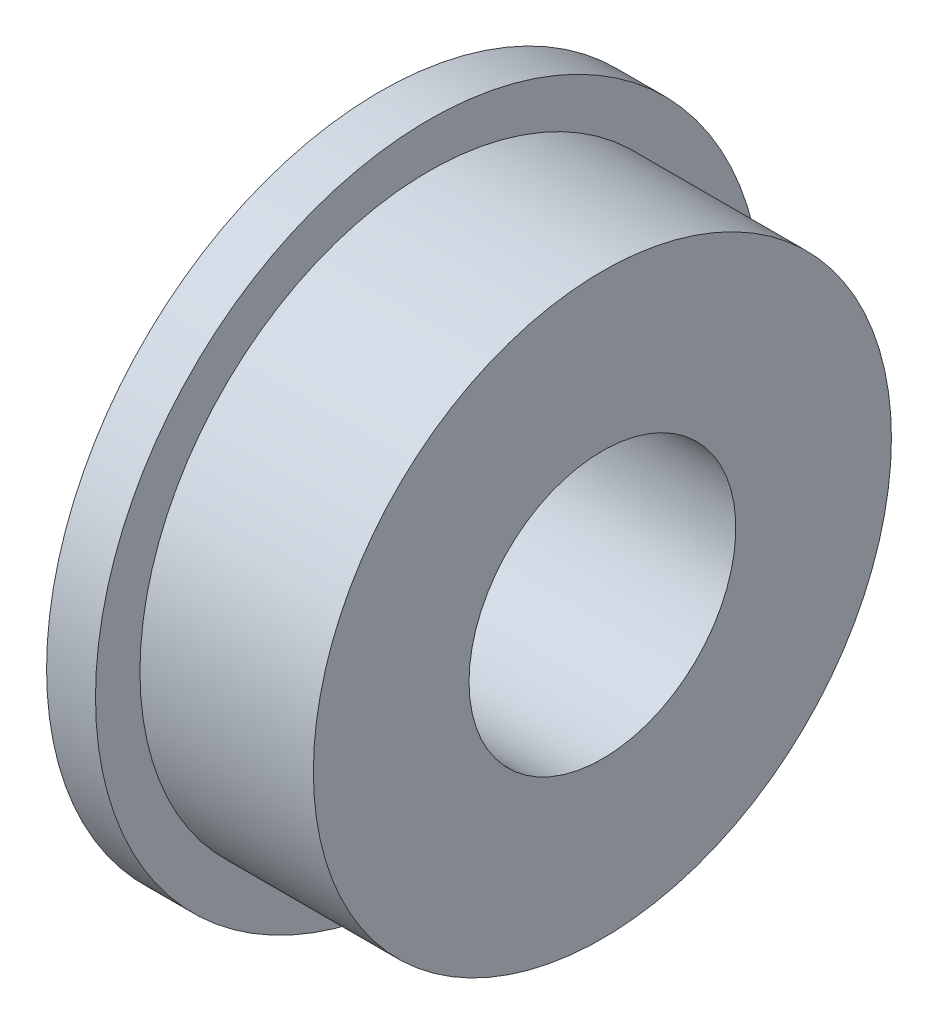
SolidWorks part; units mm, degrees
ref_plane "Front" through (0, 0, 0) normal (0, 0, 1) x (1, 0, 0)
ref_plane "Top" through (0, 0, 0) normal (0, 1, 0) x (1, 0, 0)
ref_plane "Right" through (0, 0, 0) normal (1, 0, 0) x (0, 0, -1)
sketch "Esquisse1" plane through (0, 0, 0) normal (0, 1, 0) x (1, 0, 0)
  line L0 (0, 0) -> (6.746, 0) construction
  line L1 (0, 3) -> (0, 7.5)
  line L2 (0, 7.5) -> (1.1, 7.5)
  line L3 (1.1, 7.5) -> (1.1, 6.5)
  line L4 (1.1, 6.5) -> (5, 6.5)
  line L5 (5, 6.5) -> (5, 3)
  line L6 (5, 3) -> (0, 3)
  dimension "D1" = 6
  dimension "D2" = 13
  dimension "D3" = 15
  dimension "D4" = 1.1
  dimension "D5" = 5
revolve "Révolution1" add sketch "Esquisse1" angle 360 about L0
